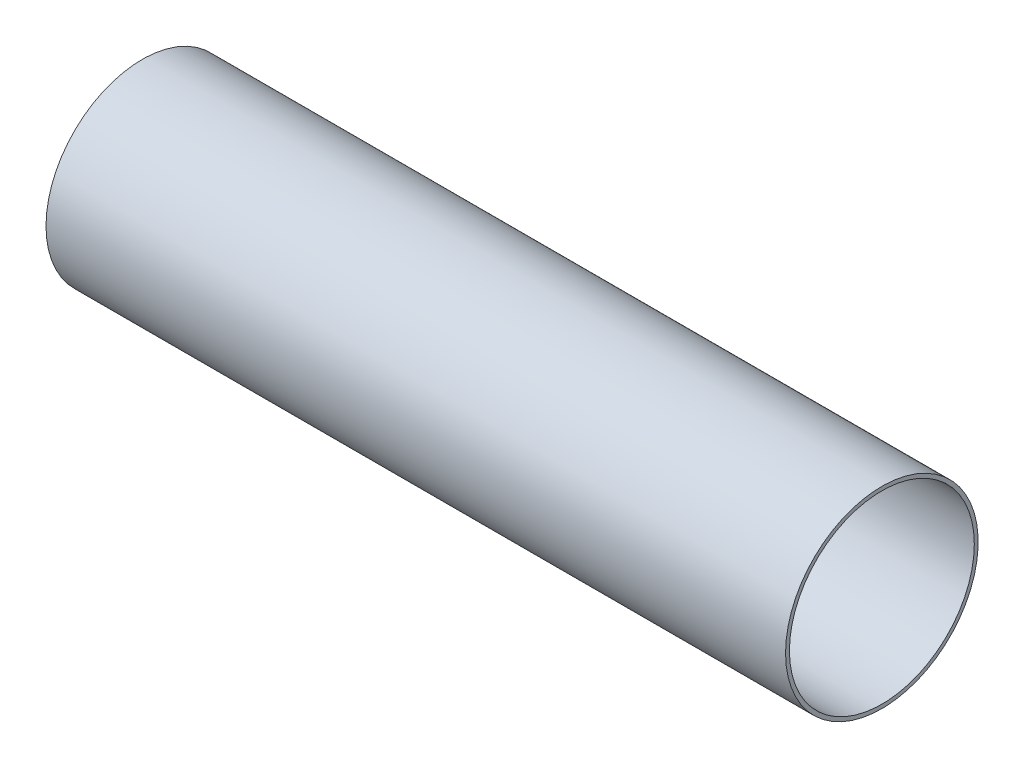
SolidWorks part; units mm, degrees
ref_plane "Front Plane" through (0, 0, 0) normal (0, 0, 1) x (1, 0, 0)
ref_plane "Top Plane" through (0, 0, 0) normal (0, 1, 0) x (1, 0, 0)
ref_plane "Right Plane" through (0, 0, 0) normal (1, 0, 0) x (0, 0, -1)
sketch "Sketch1" plane through (0, 0, 0) normal (1, 0, 0) x (0, 0, -1)
  circle A0 centre (0, 0) radius 39.6875
  circle A1 centre (0, 0) radius 38.1
  dimension "D1" = 79.375
  dimension "D2" = 76.2
extrude "Extrude1" add sketch "Sketch1" along normal blind 304.8
